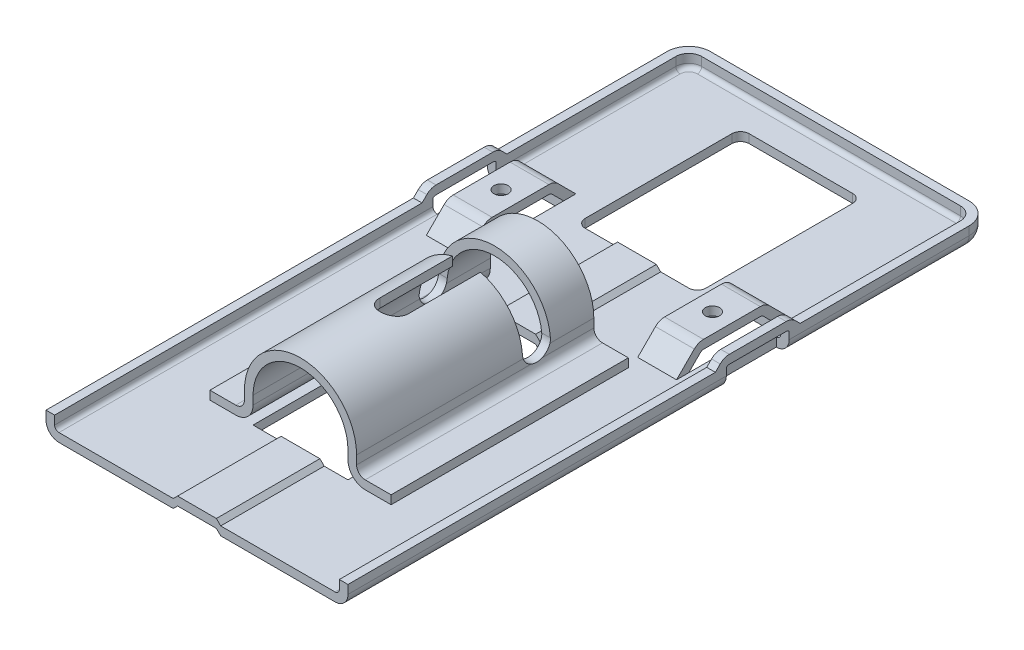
SolidWorks part; units mm, degrees
ref_plane "Plan1" through (0, 0, 0) normal (0, 0, 1) x (1, 0, 0)
ref_plane "Plan2" through (0, 0, 0) normal (0, 1, 0) x (1, 0, 0)
ref_plane "Plan3" through (0, 0, 0) normal (1, 0, 0) x (0, 0, -1)
sketch "Esquisse1" plane through (0, 0, 0) normal (0, 0, 1) x (1, 0, 0)
  line L0 (35, 0) -> (35, 5)
  line L1 (-35, 0) -> (-5.5, 0)
  line L2 (-35, 0) -> (-35, 5)
  line L3 (-33, 2) -> (-5.5, 2)
  line L4 (-33, 2) -> (-33, 5)
  line L5 (33, 2) -> (33, 5)
  line L6 (-35, 5) -> (-33, 5)
  line L7 (35, 5) -> (33, 5)
  line L8 (-31, 0) -> (-31, 2) construction
  line L9 (0, 1) -> (-4.5, 1)
  line L10 (0, 1) -> (4.5, 1)
  line L11 (0, 3) -> (-4.5, 3)
  line L12 (0, 3) -> (4.5, 3)
  line L13 (0, 3) -> (0, 1) construction
  line L14 (4.5, 1) -> (5.5, 0)
  line L15 (-4.5, 1) -> (-5.5, 0)
  line L16 (-4.5, 3) -> (-5.5, 2)
  line L17 (4.5, 3) -> (5.5, 2)
  line L18 (5.5, 0) -> (35, 0)
  line L19 (5.5, 2) -> (33, 2)
  dimension "D1" = 70
  dimension "D2" = 2
  dimension "D3" = 5
  dimension "D4" = 9
  dimension "D5" = 1
  dimension "D6" = 45
extrude "Base-Extrusion" add sketch "Esquisse1" along normal blind 102
sketch "Esquisse2" plane through (0, 0, 0) normal (0, 0, -1) x (-1, 0, 0)
  line L16 (35, 0) -> (35, 5)
  line L17 (35, 5) -> (33, 5)
  line L18 (33, 5) -> (33, 2)
  line L19 (33, 2) -> (5.5, 2)
  line L20 (5.5, 2) -> (4.5, 3)
  line L21 (4.5, 3) -> (-4.5, 3)
  line L22 (-4.5, 3) -> (-5.5, 2)
  line L23 (-5.5, 2) -> (-33, 2)
  line L24 (-33, 2) -> (-33, 5)
  line L25 (-33, 5) -> (-35, 5)
  line L26 (-35, 5) -> (-35, 0)
  line L27 (-35, 0) -> (-5.5, 0)
  line L28 (-5.5, 0) -> (-4.5, 1)
  line L29 (-4.5, 1) -> (4.5, 1)
  line L30 (4.5, 1) -> (5.5, 0)
  line L31 (5.5, 0) -> (35, 0)
  line L32 (35, 0) -> (35, 5)
  line L33 (35, 5) -> (33, 5)
  line L34 (33, 5) -> (33, 2)
  line L35 (33, 2) -> (-33, 2)
  line L40 (-33, 2) -> (-33, 5)
  line L41 (-33, 5) -> (-35, 5)
  line L42 (-35, 5) -> (-35, 0)
  line L43 (-35, 0) -> (35, 0)
  dimension "D1" = 0
extrude "Boss.-Extru.1" add sketch "Esquisse2" along normal blind 47
sketch "Esquisse3" plane through (0, 2, 0) normal (0, 1, 0) x (-1, 0, 0)
  line L1 (-12, 0) -> (12, 0)
  line L2 (-14, -2) -> (-14, -36)
  line L3 (-12, -38) -> (12, -38)
  line L4 (14, -2) -> (14, -36)
  arc A0 (-14, -36) -> (-12, -38) centre (-12, -36) ccw
  arc A1 (-12, 0) -> (-14, -2) centre (-12, -2) ccw
  arc A2 (14, -2) -> (12, 0) centre (12, -2) ccw
  arc A3 (12, -38) -> (14, -36) centre (12, -36) ccw
  point P7 (-14, -38)
  point P12 (14, 0)
  point P15 (14, -38)
  dimension "D3" = 2
  dimension "D1" = 38
  dimension "D2" = 28
extrude "Enlèv. mat.-Extru.1" cut sketch "Esquisse3" against normal through all
sketch "Esquisse4" plane through (0, 0, -47) normal (0, 0, -1) x (-1, 0, 0)
  line L0 (35, 0) -> (35, 5) construction
  line L1 (-35, 5) -> (-35, 0) construction
  line L2 (-35, 0) -> (35, 0) construction
  line L3 (35, 0) -> (35, 5)
  line L4 (-35, 5) -> (-35, 0)
  line L5 (-35, 0) -> (35, 0)
  line L6 (35, 5) -> (-35, 5)
extrude "Boss.-Extru.2" add sketch "Esquisse4" against normal blind 2
fillet "Congé1" radius 3
fillet "Congé2" radius 5
fillet "Congé3" radius 1
fillet "Congé4" radius 3
sketch "Esquisse5" plane through (0, 0, 0) normal (0, -1, 0) x (1, 0, 0)
  line L0 (0, 28) -> (0, 78) construction
  line L1 (-11, 78) -> (11, 78)
  line L2 (-11, 78) -> (-11, 44)
  line L3 (-8, 28) -> (8, 28)
  line L4 (11, 78) -> (11, 44)
  line L5 (5.5, 102) -> (32, 102) construction
  line L6 (8, 36.2812) -> (0, 36.2812) construction
  line L7 (0, 36.2812) -> (-8, 36.2812) construction
  line L8 (0, 0) -> (29, 0) construction
  line L9 (20, 17) -> (29, 17)
  line L10 (20, 17) -> (20, -3)
  line L11 (20, -3) -> (29, -3)
  line L12 (29, 17) -> (29, -3)
  line L13 (-29, 17) -> (-20, 17)
  line L14 (-29, 17) -> (-29, -3)
  line L15 (-29, -3) -> (-20, -3)
  line L16 (-20, 17) -> (-20, -3)
  line L17 (0, 0) -> (-29, 0) construction
  line L18 (30, -47) -> (-30, -47) construction
  arc A0 (8, 28) -> (11, 44) centre (8, 36.2812) ccw
  arc A1 (-11, 44) -> (-8, 28) centre (-8, 36.2812) ccw
  dimension "D4" = 16
  dimension "D1" = 50
  dimension "D2" = 22
  dimension "D3" = 24
  dimension "D5" = 16
  dimension "D6" = 9
  dimension "D7" = 20
  dimension "D8" = 58
  dimension "D9" = 44
extrude "Enlèv. mat.-Extru.2" cut sketch "Esquisse5" against normal through all
sketch "Esquisse7" plane through (-29, 0, 0) normal (1, 0, 0) x (0, 0, -1)
  line L0 (-17, 2) -> (-14.2929, 4.7071)
  line L1 (-13.5858, 5) -> (-0.4142, 5)
  line L2 (3, 2) -> (0.2929, 4.7071)
  line L3 (-17, 2) -> (3, 2) construction
  line L4 (5.8284, 2) -> (1.7071, 6.1213)
  line L5 (-13.5858, 7) -> (-0.4142, 7)
  line L6 (-19.8284, 2) -> (-15.7071, 6.1213)
  line L7 (3, 2) -> (5.8284, 2)
  line L8 (-17, 2) -> (-19.8284, 2)
  arc A0 (-13.5858, 5) -> (-14.2929, 4.7071) centre (-13.5858, 4) ccw
  arc A1 (0.2929, 4.7071) -> (-0.4142, 5) centre (-0.4142, 4) ccw
  arc A2 (-13.5858, 7) -> (-15.7071, 6.1213) centre (-13.5858, 4) ccw
  arc A3 (1.7071, 6.1213) -> (-0.4142, 7) centre (-0.4142, 4) ccw
  dimension "D4" = 1
  dimension "D5" = 3
  dimension "D1" = 3
  dimension "D2" = 2
  dimension "D3" = 45
extrude "Boss.-Extru.3" add sketch "Esquisse7" along normal up to surface (9 mm away)
sketch "Esquisse8" plane through (20, 0, 0) normal (1, 0, 0) x (0, 0, -1)
  line L8 (-15.7071, 6.1213) -> (-19.8284, 2)
  line L9 (-19.8284, 2) -> (-17, 2)
  line L10 (-17, 2) -> (-14.2929, 4.7071)
  line L11 (-13.5858, 5) -> (-0.4142, 5)
  line L12 (0.2929, 4.7071) -> (3, 2)
  line L13 (3, 2) -> (5.8284, 2)
  line L14 (5.8284, 2) -> (1.7071, 6.1213)
  line L15 (-0.4142, 7) -> (-13.5858, 7)
  line L16 (-15.7071, 6.1213) -> (-19.8284, 2)
  line L17 (-19.8284, 2) -> (-17, 2)
  line L18 (-17, 2) -> (-14.2929, 4.7071)
  line L19 (-13.5858, 5) -> (-0.4142, 5)
  line L20 (0.2929, 4.7071) -> (3, 2)
  line L21 (3, 2) -> (5.8284, 2)
  line L22 (5.8284, 2) -> (1.7071, 6.1213)
  line L23 (-0.4142, 7) -> (-13.5858, 7)
  arc A4 (-13.5858, 5) -> (-14.2929, 4.7071) centre (-13.5858, 4) ccw
  arc A5 (0.2929, 4.7071) -> (-0.4142, 5) centre (-0.4142, 4) ccw
  arc A6 (1.7071, 6.1213) -> (-0.4142, 7) centre (-0.4142, 4) ccw
  arc A7 (-13.5858, 7) -> (-15.7071, 6.1213) centre (-13.5858, 4) ccw
  arc A8 (-13.5858, 5) -> (-14.2929, 4.7071) centre (-13.5858, 4) ccw
  arc A9 (0.2929, 4.7071) -> (-0.4142, 5) centre (-0.4142, 4) ccw
  arc A10 (1.7071, 6.1213) -> (-0.4142, 7) centre (-0.4142, 4) ccw
  arc A11 (-13.5858, 7) -> (-15.7071, 6.1213) centre (-13.5858, 4) ccw
  dimension "D1" = 0
extrude "Boss.-Extru.4" add sketch "Esquisse8" along normal up to surface (9 mm away)
sketch "Esquisse9" plane through (-35, 0, 0) normal (-1, 0, 0) x (0, 0, 1)
  line L1 (102, 5) -> (-42, 5) construction
  line L2 (16.8284, 5) -> (-2.8284, 5)
  line L8 (17, 2) -> (19.8284, 2)
  line L9 (19.8284, 2) -> (15.7071, 6.1213)
  line L10 (13.5858, 7) -> (0.4142, 7)
  line L11 (-1.7071, 6.1213) -> (-5.8284, 2)
  line L12 (-5.8284, 2) -> (-3, 2)
  line L13 (-3, 2) -> (-0.2929, 4.7071)
  line L14 (0.4142, 5) -> (13.5858, 5)
  line L15 (14.2929, 4.7071) -> (17, 2)
  line L17 (16.8284, 5) -> (15.7071, 6.1213)
  line L18 (13.5858, 7) -> (0.4142, 7)
  line L19 (-1.7071, 6.1213) -> (-2.8284, 5)
  arc A4 (15.7071, 6.1213) -> (13.5858, 7) centre (13.5858, 4) ccw
  arc A5 (0.4142, 7) -> (-1.7071, 6.1213) centre (0.4142, 4) ccw
  arc A6 (0.4142, 5) -> (-0.2929, 4.7071) centre (0.4142, 4) ccw
  arc A7 (14.2929, 4.7071) -> (13.5858, 5) centre (13.5858, 4) ccw
  arc A8 (15.7071, 6.1213) -> (13.5858, 7) centre (13.5858, 4) ccw
  arc A9 (0.4142, 7) -> (-1.7071, 6.1213) centre (0.4142, 4) ccw
  dimension "D1" = 0
extrude "Boss.-Extru.5" add sketch "Esquisse9" against normal up to surface (2 mm away)
sketch "Esquisse10" plane through (35, 0, 0) normal (1, 0, 0) x (0, 0, -1)
  line L0 (5.8284, 2) -> (1.7071, 6.1213) construction
  line L1 (-0.4142, 7) -> (-13.5858, 7) construction
  line L2 (-15.7071, 6.1213) -> (-19.8284, 2) construction
  line L3 (2.8284, 5) -> (1.7071, 6.1213)
  line L4 (-0.4142, 7) -> (-13.5858, 7)
  line L5 (-15.7071, 6.1213) -> (-16.8284, 5)
  line L6 (-102, 5) -> (42, 5) construction
  line L7 (-16.8284, 5) -> (2.8284, 5)
  arc A0 (1.7071, 6.1213) -> (-0.4142, 7) centre (-0.4142, 4) ccw construction
  arc A1 (-13.5858, 7) -> (-15.7071, 6.1213) centre (-13.5858, 4) ccw construction
  arc A2 (1.7071, 6.1213) -> (-0.4142, 7) centre (-0.4142, 4) ccw
  arc A3 (-13.5858, 7) -> (-15.7071, 6.1213) centre (-13.5858, 4) ccw
extrude "Boss.-Extru.6" add sketch "Esquisse10" against normal up to surface (2 mm away)
sketch "Esquisse11" plane through (35, 0, 0) normal (1, 0, 0) x (0, 0, -1)
  line L0 (-13.5858, 5) -> (-0.4142, 5) construction
  line L1 (-13.5858, 5) -> (-0.4142, 5)
  line L2 (-14.2929, 0) -> (-14.2929, 4.7071)
  line L3 (42, 0) -> (-102, 0) construction
  line L5 (0.2929, 4.7071) -> (0.2929, 0)
  line L6 (0.2929, 4.7071) -> (3, 2) construction
  line L7 (-17, 2) -> (-14.2929, 4.7071) construction
  line L8 (0.2929, 0) -> (-14.2929, 0)
  arc A0 (-13.5858, 5) -> (-14.2929, 4.7071) centre (-13.5858, 4) ccw
  arc A1 (0.2929, 4.7071) -> (-0.4142, 5) centre (-0.4142, 4) ccw
  arc A2 (-13.5858, 5) -> (-14.2929, 4.7071) centre (-13.5858, 4) ccw construction
  arc A4 (0.2929, 4.7071) -> (-0.4142, 5) centre (-0.4142, 4) ccw construction
extrude "Enlèv. mat.-Extru.3" cut sketch "Esquisse11" against normal blind 3
sketch "Esquisse12" plane through (-35, 0, 0) normal (-1, 0, 0) x (0, 0, 1)
  line L0 (-0.2929, 3) -> (-0.2929, 4.7071) construction
  line L1 (-0.2929, 0) -> (-0.2929, 3) construction
  line L2 (14.2929, 0) -> (-0.2929, 0) construction
  line L3 (14.2929, 3) -> (14.2929, 0) construction
  line L4 (14.2929, 4.7071) -> (14.2929, 3) construction
  line L5 (0.4142, 5) -> (13.5858, 5) construction
  line L6 (-0.2929, 3) -> (-0.2929, 4.7071)
  line L7 (-0.2929, 0) -> (-0.2929, 3)
  line L8 (14.2929, 0) -> (-0.2929, 0)
  line L9 (14.2929, 3) -> (14.2929, 0)
  line L10 (14.2929, 4.7071) -> (14.2929, 3)
  line L11 (0.4142, 5) -> (13.5858, 5)
  arc A0 (0.4142, 5) -> (-0.2929, 4.7071) centre (0.4142, 4) ccw construction
  arc A1 (14.2929, 4.7071) -> (13.5858, 5) centre (13.5858, 4) ccw construction
  arc A2 (0.4142, 5) -> (-0.2929, 4.7071) centre (0.4142, 4) ccw
  arc A3 (14.2929, 4.7071) -> (13.5858, 5) centre (13.5858, 4) ccw
extrude "Enlèv. mat.-Extru.4" cut sketch "Esquisse12" against normal blind 3
sketch "Esquisse13" plane through (0, 0, 78) normal (0, 0, -1) x (-1, 0, 0)
  line L0 (32, 0) -> (5.5, 0) construction
  line L1 (-11, 8) -> (-11, 6)
  line L2 (11, 8) -> (11, 6)
  line L3 (5.5, 2) -> (32, 2) construction
  line L4 (-32, 2) -> (-5.5, 2) construction
  line L5 (15, 2) -> (21, 2)
  line L6 (-21, 2) -> (-15, 2)
  line L7 (15, 4) -> (21, 4)
  line L8 (13, 8) -> (13, 6)
  line L9 (-13, 8) -> (-13, 6)
  line L10 (-21, 4) -> (-15, 4)
  line L11 (-21, 4) -> (-21, 2)
  line L12 (21, 4) -> (21, 2)
  arc A0 (11, 8) -> (-11, 8) centre (0, 8) ccw
  arc A1 (13, 8) -> (-13, 8) centre (0, 8) ccw
  arc A2 (-15, 4) -> (-13, 6) centre (-15, 6) ccw
  arc A3 (15, 4) -> (13, 6) centre (15, 6) cw
  arc A4 (15, 2) -> (11, 6) centre (15, 6) cw
  arc A5 (-15, 2) -> (-11, 6) centre (-15, 6) ccw
  point P28 (-11, 2)
  dimension "D1" = 22
  dimension "D5" = 2
  dimension "D6" = 4
  dimension "D2" = 8
  dimension "D4" = 10
  dimension "D3" = 2
extrude "Boss.-Extru.7" add sketch "Esquisse13" along normal blind 55
sketch "Esquisse14" plane through (0, 0, 0) normal (0, -1, 0) x (1, 0, 0)
  line L0 (8, 36.2812) -> (-8, 36.2812) construction
  line L1 (0, 23) -> (0, 78) construction
  line L2 (3.25, 56.2812) -> (3.25, 36.2812)
  line L3 (-3.25, 36.2812) -> (-3.25, 56.2812)
  arc A0 (-3.25, 36.2812) -> (3.25, 36.2812) centre (0, 36.2812) ccw
  arc A1 (3.25, 56.2812) -> (-3.25, 56.2812) centre (0, 56.2812) ccw
  dimension "D2" = 6.5
  dimension "D1" = 20
extrude "Enlèv. mat.-Extru.5" cut sketch "Esquisse14" against normal through all
sketch "Esquisse15" plane through (13, 0, 0) normal (1, 0, 0) x (0, 0, -1)
  line L0 (-36.2812, 2) -> (-36.2812, 0) construction
  line L1 (-36.2812, 20.5872) -> (-36.2812, 18.5089) construction
  line L2 (-23, 21) -> (-33.0312, 21) construction
  line L3 (-33.0313, 21) -> (-39.5313, 21)
  line L4 (-33.0312, 9) -> (-33.0313, 21)
  line L5 (-39.5312, 9) -> (-39.5313, 21)
  arc A0 (-39.5312, 9) -> (-33.0312, 9) centre (-36.2812, 9) ccw
  dimension "D2" = 6.5
  dimension "D1" = 12
extrude "Enlèv. mat.-Extru.6" cut sketch "Esquisse15" against normal up to surface and the other way up to surface
hole_wizard "Perçage1" positions "Esquisse17" profile "Esquisse16" tap size "M4x0.7" standard "ISO"
sketch "Esquisse17" plane through (0, 7, 0) normal (0, 1, 0) x (-1, 0, 0)
  line L0 (-24.5, 7) -> (-24.5, 0.4142) construction
  line L1 (-29, 0.4142) -> (-20, 0.4142) construction
  line L2 (-24.5, 7) -> (-29, 7) construction
  line L3 (-29, 0.4142) -> (-29, 13.5858) construction
  line L4 (-24.5, 7) -> (-20, 7) construction
  line L5 (-20, 0.4142) -> (-20, 13.5858) construction
  line L6 (-24.5, 7) -> (-24.5, 13.5858) construction
  line L7 (-29, 13.5858) -> (-20, 13.5858) construction
  point P0 (-24.5, 7)
sketch "Esquisse16" plane through (24.5, 7, 7) normal (1, 0, 0) x (0, 0, 1)
  line L0 (0, 0) -> (0, 7)
  line L1 (0, 7) -> (1.65, 7)
  line L2 (1.65, 7) -> (1.65, 0)
  line L5 (1.65, 0) -> (0, 0)
  line L11 (0, -6.35) -> (0, 107.95) construction
  dimension "Diamètre du perçage jusqu'au prochain" = 3.3
  dimension "Profondeur du perçage jusqu'au prochain" = 7.0001
hole_wizard "Perçage2" positions "Esquisse20" profile "Esquisse19" tap size "M4x0.7" standard "ISO"
sketch "Esquisse20" plane through (0, 7, 0) normal (0, 1, 0) x (-1, 0, 0)
  line L0 (24.5, 7) -> (20, 7) construction
  line L2 (20, 0.4142) -> (20, 13.5858) construction
  line L3 (24.5, 7) -> (29, 7) construction
  line L4 (29, 0.4142) -> (29, 13.5858) construction
  line L5 (24.5, 7) -> (24.5, 0.4142) construction
  line L6 (20, 0.4142) -> (29, 0.4142) construction
  line L7 (24.5, 7) -> (24.5, 13.5858) construction
  line L8 (20, 13.5858) -> (29, 13.5858) construction
  point P0 (24.5, 7)
sketch "Esquisse19" plane through (-24.5, 7, 7) normal (1, 0, 0) x (0, 0, 1)
  line L0 (0, 0) -> (0, 7.0001)
  line L1 (0, 7.0001) -> (1.65, 7.0001)
  line L2 (1.65, 7.0001) -> (1.65, 0)
  line L5 (1.65, 0) -> (0, 0)
  line L11 (0, -6.35) -> (0, 107.95) construction
  dimension "Diamètre du perçage jusqu'au prochain" = 3.3
  dimension "Profondeur du perçage jusqu'au prochain" = 7.0001
